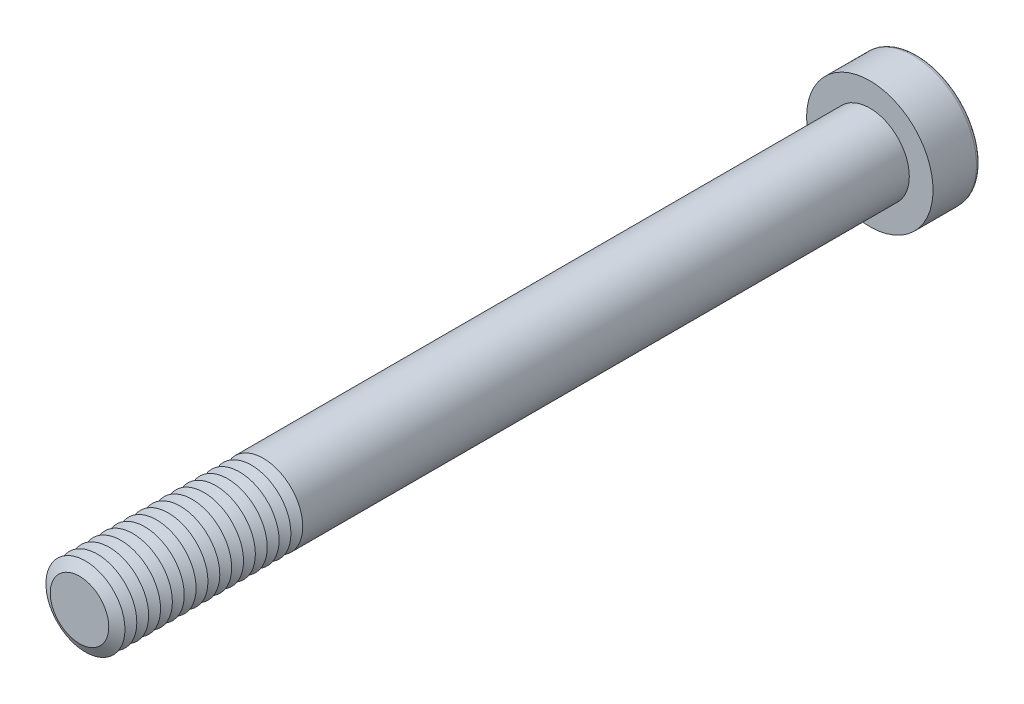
SolidWorks part; units mm, degrees
ref_plane "Front Plane" through (0, 0, 0) normal (0, 0, 1) x (1, 0, 0)
ref_plane "Top Plane" through (0, 0, 0) normal (0, 1, 0) x (1, 0, 0)
ref_plane "Right Plane" through (0, 0, 0) normal (1, 0, 0) x (0, 0, -1)
sketch "Sketch1" plane through (0, 0, 0) normal (0, 0, 1) x (1, 0, 0)
  circle A0 centre (0, 0) radius 5
  dimension "D1" = 10
extrude "Boss-Extrude1" add sketch "Sketch1" along normal blind 100
sketch "Sketch2" plane through (0, 0, 0) normal (0, 0, -1) x (-1, 0, 0)
  circle A0 centre (0, 0) radius 8
  dimension "D1" = 16
extrude "Boss-Extrude2" add sketch "Sketch2" along normal blind 6
sketch "Sketch3" plane through (0, 0, -6) normal (0, 0, -1) x (-1, 0, 0)
  line L1 (-2.0207, 3.5) -> (-4.0415, 0)
  line L2 (-4.0415, 0) -> (-2.0207, -3.5)
  line L3 (-2.0207, -3.5) -> (2.0207, -3.5)
  line L4 (2.0207, -3.5) -> (4.0415, 0)
  line L5 (4.0415, 0) -> (2.0207, 3.5)
  line L6 (2.0207, 3.5) -> (-2.0207, 3.5)
  circle A0 centre (0, 0) radius 3.5 construction
  dimension "D1" = 7
extrude "Cut-Extrude1" cut sketch "Sketch3" against normal blind 5.25
fillet "Fillet1" radius 0.5 1 edges at (-8, 0, -6)
sketch "Sketch4" plane through (0, 0, -0.75) normal (0, 0, -1) x (-1, 0, 0)
  line L0 (2.0207, -3.5) -> (4.0415, 0) construction
  circle A0 centre (0, 0) radius 3.5
extrude "Cut-Extrude2" cut sketch "Sketch4" against normal through all draft 60
sketch "Sketch5" plane through (0, 0, -6) normal (0, 0, -1) x (-1, 0, 0)
  circle A0 centre (0, 0) radius 4.0415
extrude "Cut-Extrude3" cut sketch "Sketch5" against normal through all draft 75
sketch "Sketch7" plane through (0, 0, 0) normal (1, 0, 0) x (0, 0, -1)
  line L25 (-100, 3.701) -> (-99.25, 5)
  line L26 (-100, 5) -> (-100, -5) construction
  line L27 (-99.25, 5) -> (-100.75, 5)
  line L28 (-100.75, 5) -> (-100, 3.701)
  line L29 (0, 5) -> (-100, 5) construction
  dimension "D1" = 1.5
revolve "Cut-Revolve1" cut sketch "Sketch7" angle 360 about axis through (0, 0, 100) along (0, 0, -1)
pattern_linear "LPattern1" count 16 spacing 1.5 along (0, 0, -1) of "Cut-Revolve1"
